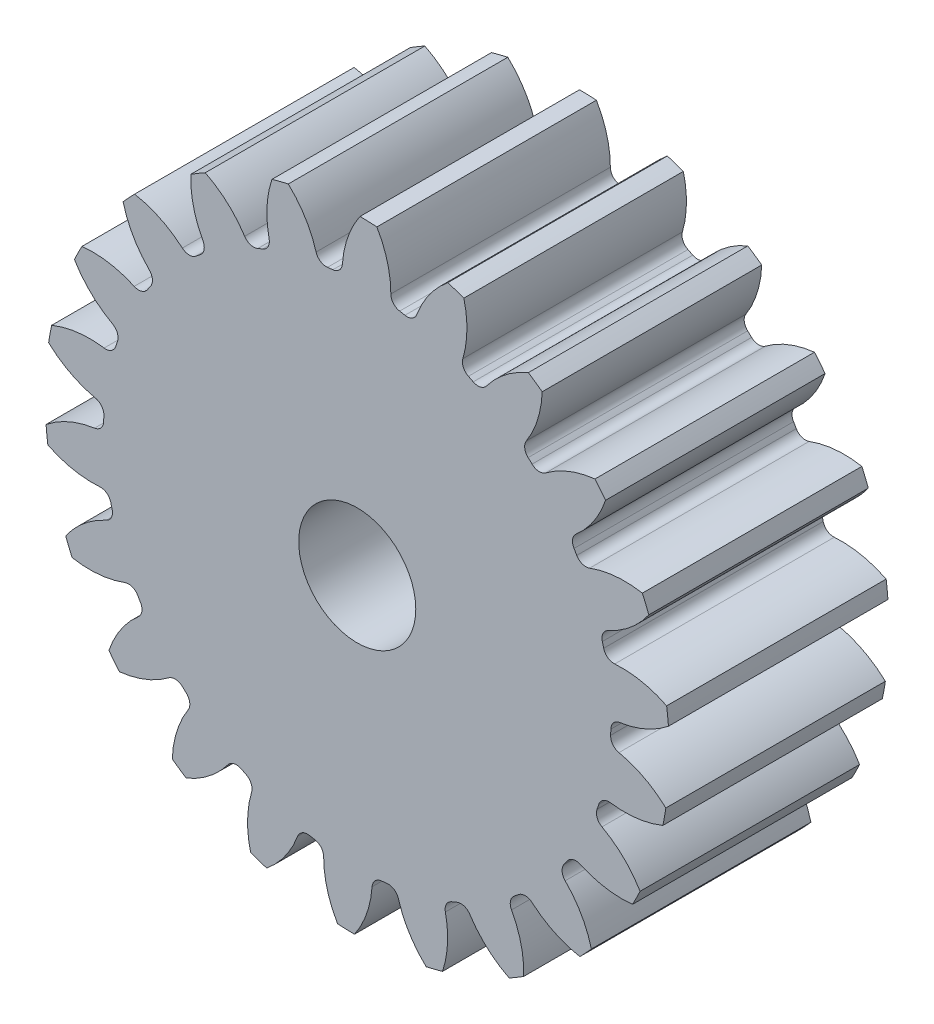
SolidWorks part; units mm, degrees
ref_plane "Front" through (0, 0, 0) normal (0, 0, 1) x (1, 0, 0)
ref_plane "Top" through (0, 0, 0) normal (0, 1, 0) x (1, 0, 0)
ref_plane "Right" through (0, 0, 0) normal (1, 0, 0) x (0, 0, -1)
sketch "Sketch3" plane through (0, 0, 0) normal (0, 0, 1) x (1, 0, 0)
  circle A0 centre (0, 0) radius 135.4667
  dimension "od" = 270.9333
extrude "gearBody" add sketch "Sketch3" along normal blind 95.25
sketch "Sketch2" plane through (0, 0, 0) normal (0, 0, 1) x (1, 0, 0)
  line L0 (0, 0) -> (107.8065, 44.6549) construction
  line L1 (134.3187, -20.8407) -> (0, 0) construction
  line L2 (0, 0) -> (36.3143, 0) construction
  line L3 (124.1002, 4.3897) -> (123.4667, -13.2701) construction
  line L5 (123.7834, -4.4402) -> (0, 0) construction
  line L7 (0, 0) -> (116.6889, 0) construction
  arc A0 (116.6695, 2.1317) -> (116.2169, -10.4855) centre (0, 0) ccw construction
  arc A1 (135.0346, 10.8111) -> (133.9129, -20.4584) centre (0, 0) ccw construction
  arc A2 (124.1002, 4.3897) -> (123.4667, -13.2701) centre (0, 0) ccw construction
  arc A3 (109.9477, -5.1164) -> (110.0317, -2.7744) centre (0, 0) ccw
  arc A4 (134.3187, -20.8407) -> (113.5609, -9.8196) centre (104.33, -52.2644) ccw
  arc A5 (134.3187, -20.8407) -> (135.4667, 11.1633) centre (0, 0) ccw
  arc A6 (135.4667, 11.1633) -> (113.9726, 1.6578) centre (107.8065, 44.6549) cw
  arc A7 (110.0317, -2.7744) -> (113.9726, 1.6578) centre (114.6248, -2.8903) cw
  arc A8 (113.5609, -9.8196) -> (109.9477, -5.1164) centre (114.5373, -5.3299) cw
  point P6 (135.4667, 11.1633)
  point P22 (134.3187, -20.8407)
  dimension "baseDia" = 233.3779
  dimension "od" = 270.9333
  dimension "pd" = 248.3556
  dimension "rd" = 220.1333
  dimension "rFillet" = 4.5946
  dimension "pointX" = 135.4667
  dimension "pointY" = 11.1633
  dimension "CTT" = 17.6597
  dimension "flankCenterAngle" = 22.5
extrude "toothCut" cut sketch "Sketch2" along normal through all
pattern_circular "CirPattern1" count 22 over 360 about axis through (0, 0, 0) along (0, 0, 1) of "toothCut"
sketch "hub1Dia" plane through (0, 0, 0) normal (0, 0, -1) x (-1, 0, 0)
  circle A0 centre (0, 0) radius 12.7
  dimension "hub1Dia" = 25.4
sketch "hub2Dia" plane through (0, 0, 95.25) normal (0, 0, 1) x (1, 0, 0)
  circle A0 centre (0, 0) radius 12.7
  dimension "hub2dia" = 25.4
sketch "boreDia" plane through (0, 0, 0) normal (0, 0, 1) x (1, 0, 0)
  circle A0 centre (0, 0) radius 25.4
  dimension "boreDia" = 50.8
extrude "bore" cut sketch "boreDia" against normal mid plane 25400
